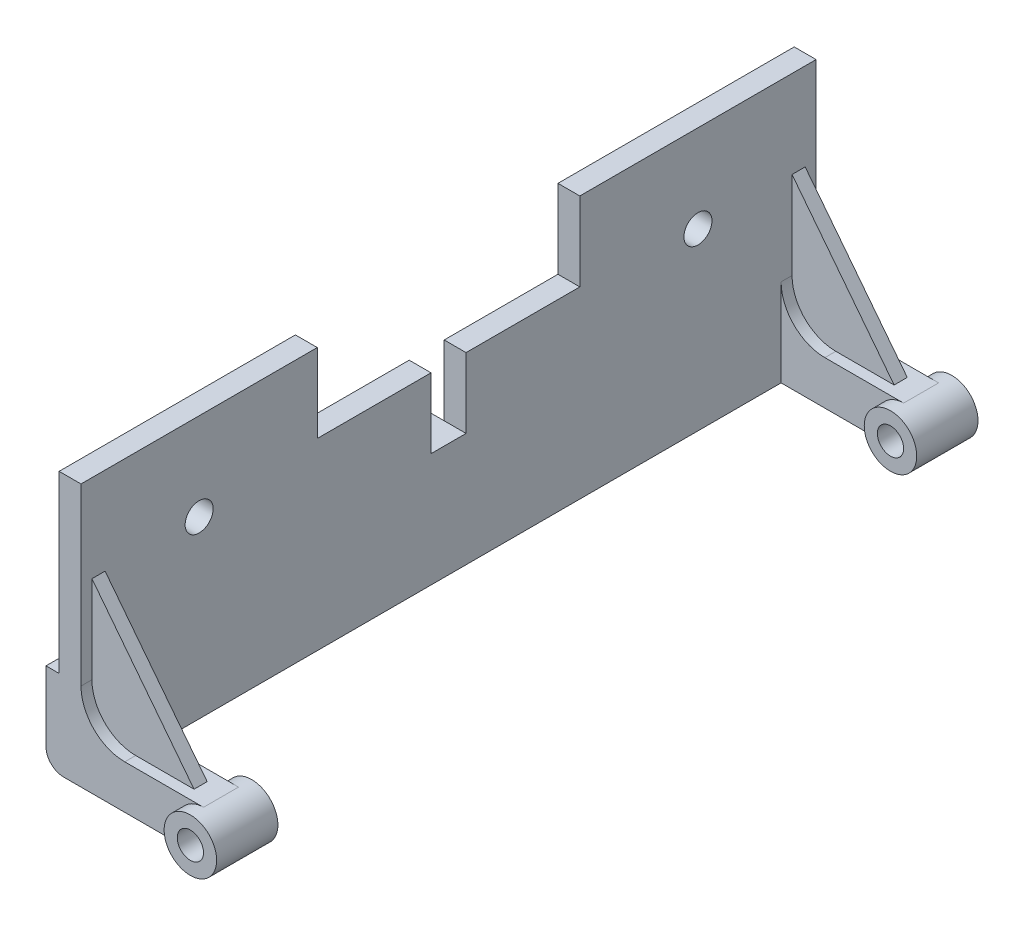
SolidWorks part; units mm, degrees
ref_plane "Face" through (0, 0, 0) normal (0, 0, 1) x (1, 0, 0)
ref_plane "Dessus" through (0, 0, 0) normal (0, 1, 0) x (1, 0, 0)
ref_plane "Droite" through (0, 0, 0) normal (1, 0, 0) x (0, 0, -1)
sketch "Esquisse1" plane through (0, 0, 0) normal (0, 0, 1) x (1, 0, 0)
  line L1 (-18, -2) -> (-14, -2)
  line L2 (-18, -2) -> (-18, 28)
  line L3 (-18, 28) -> (-14, 28)
  line L4 (-14, -2) -> (-14, 28)
  dimension "D1" = 30
  dimension "D2" = 4
  dimension "D3" = 14
  dimension "D4" = 2
extrude "Extrusion1" add sketch "Esquisse1" along normal blind 42
sketch "Esquisse2" plane through (0, 0, 42) normal (0, 0, 1) x (1, 0, 0)
  line L0 (-14, 3) -> (-14, -2)
  line L1 (-14, -2) -> (-2.2361, -2)
  line L2 (0, 3) -> (-14, 3)
  arc A0 (-2.2361, -2) -> (0, 3) centre (0, 0) ccw
  dimension "D1" = 6
extrude "Extrusion2" add sketch "Esquisse2" against normal blind 4
sketch "Esquisse3" plane through (0, 0, 38) normal (0, 0, -1) x (-1, 0, 0)
  circle A0 centre (0, 0) radius 3
  dimension "D1" = 6
extrude "Extrusion3" add sketch "Esquisse3" along normal blind 1.5
fillet "Congé1" radius 5 1 edges
ref_plane "Plan1" through (0, 0, 40) normal (0, 0, 1) x (1, 0, 0)
sketch "Esquisse6" plane through (0, 0, 40) normal (0, 0, 1) x (1, 0, 0)
  line L0 (-14, 18) -> (0, 0)
  line L1 (-14, 8) -> (-14, 28) construction
rib "Nervure1" sketch "Esquisse6" sketch "Esquisse6" thickness 1.5 extrusion direction parallel to sketch draft on no parameters "D1"=1.5
sketch "Esquisse7" plane through (0, 0, 0) normal (0, 0, 1) x (1, 0, 0)
  line L1 (-18, 28) -> (-16.5, 28)
  line L2 (-18, 28) -> (-18, 8)
  line L3 (-18, 8) -> (-16.5, 8)
  line L4 (-16.5, 28) -> (-16.5, 8)
  dimension "D1" = 1.5
  dimension "D2" = 20
extrude "Enlèv. mat.-Extru.3" cut sketch "Esquisse7" along normal through all
sketch "Esquisse11" plane through (0, 0, 42) normal (0, 0, 1) x (1, 0, 0)
  circle A0 centre (0, 0) radius 3
extrude "Extrusion5" add sketch "Esquisse11" along normal blind 1.5
sketch "Esquisse12" plane through (0, 0, 43.5) normal (0, 0, 1) x (1, 0, 0)
  circle A0 centre (0, 0) radius 1.5
  dimension "D1" = 3
extrude "Enlèv. mat.-Extru.6" cut sketch "Esquisse12" against normal through all
sketch "Esquisse15" plane through (-16.5, 0, 0) normal (-1, 0, 0) x (0, 0, 1)
  line L1 (42, 28) -> (0, 28) construction
  line L2 (42, 8) -> (42, 28) construction
  circle A0 centre (28.5, 18) radius 1.6
  dimension "D1" = 3.2
  dimension "D2" = 10
  dimension "D3" = 13.5
extrude "Enlèv. mat.-Extru.8" cut sketch "Esquisse15" against normal through all
mirror "Symétrie1" about plane through (-18, 28, 0) normal (0, 0, -1)
fillet "Congé3" radius 2 1 edges at (-18, -2, 0)
sketch "Esquisse9" plane through (-16.5, 0, 0) normal (-1, 0, 0) x (0, 0, 1)
  line L0 (42, 28) -> (-42, 28) construction
  line L1 (-15, 28) -> (15, 28)
  line L2 (-15, 28) -> (-15, 19)
  line L3 (-15, 19) -> (15, 19)
  line L4 (15, 28) -> (15, 19)
  line L5 (0, -12.2679) -> (0, 87.7321) construction
  dimension "D1" = 30
  dimension "D2" = 15
  dimension "D3" = 9
extrude "Enlèv. mat.-Extru.5" cut sketch "Esquisse9" against normal through all
sketch "Esquisse13" plane through (-14, 0, 0) normal (1, 0, 0) x (0, 0, -1)
  line L0 (15, 19) -> (-15, 19) construction
  line L1 (-2, 19) -> (2, 19)
  line L2 (-2, 19) -> (-2, 11)
  line L3 (-2, 11) -> (2, 11)
  line L4 (2, 19) -> (2, 11)
  dimension "D1" = 4
  dimension "D2" = 2
  dimension "D3" = 8
extrude "Enlèv. mat.-Extru.7" cut sketch "Esquisse13" against normal through all
sketch "Esquisse14" plane through (-16.5, 0, 0) normal (-1, 0, 0) x (0, 0, 1)
  line L0 (42, 8) -> (-42, 8) construction
  line L1 (-2, 11) -> (2, 11)
  line L2 (-2, 11) -> (-2, 8)
  line L3 (-2, 8) -> (2, 8)
  line L4 (2, 11) -> (2, 8)
  dimension "D1" = 4
extrude "Extrusion6" add sketch "Esquisse14" along normal up to surface (1.5 mm away)
